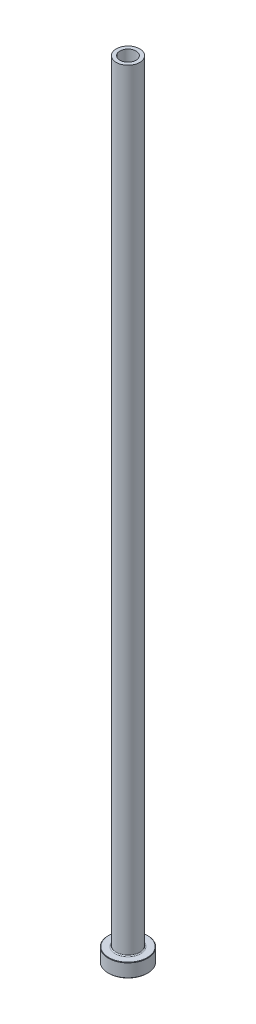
SolidWorks part; units mm, degrees
ref_plane "Front Plane" through (0, 0, 0) normal (0, 0, 1) x (1, 0, 0)
ref_plane "Top Plane" through (0, 0, 0) normal (0, 1, 0) x (1, 0, 0)
ref_plane "Right Plane" through (0, 0, 0) normal (1, 0, 0) x (0, 0, -1)
sketch "Sketch1" plane through (0, 0, 0) normal (0, 0, 1) x (1, 0, 0)
  line L0 (-4.1, 400) -> (-6, 400)
  line L1 (-6, 400) -> (-6, 7)
  line L2 (-6, 7) -> (-10, 7)
  line L3 (-10, 7) -> (-10, 0)
  line L4 (11, 0) -> (-11, 0) construction
  line L5 (-10, 0) -> (-4.35, 0)
  line L6 (-4.1, 355) -> (-4.1, 400)
  line L7 (0, 92.1877) -> (0, -15.5353) construction
  line L8 (0, -11) -> (0, 11) construction
  line L9 (-4.1, 355) -> (-4.35, 343)
  line L10 (-4.35, 343) -> (-4.35, 0)
  dimension "D1" = 0.25
  dimension "ID" = 8.2
  dimension "OD" = 12
  dimension "L" = 400
  dimension "H" = 20
  dimension "T" = 7
  dimension "N" = 45
  dimension "D2" = 12
revolve "Revolve1" add sketch "Sketch1" angle 360 about L7
fillet "Fillet1" radius 0.5 1 edges at (0, 7, 6)
chamfer "Chamfer1" distance 0.2 angle 45 2 edges at (0, 7, 10) (0, 0, 10)
chamfer "Chamfer3" distance 0.5 angle 45 1 edges at (0, 0, 4.35)
